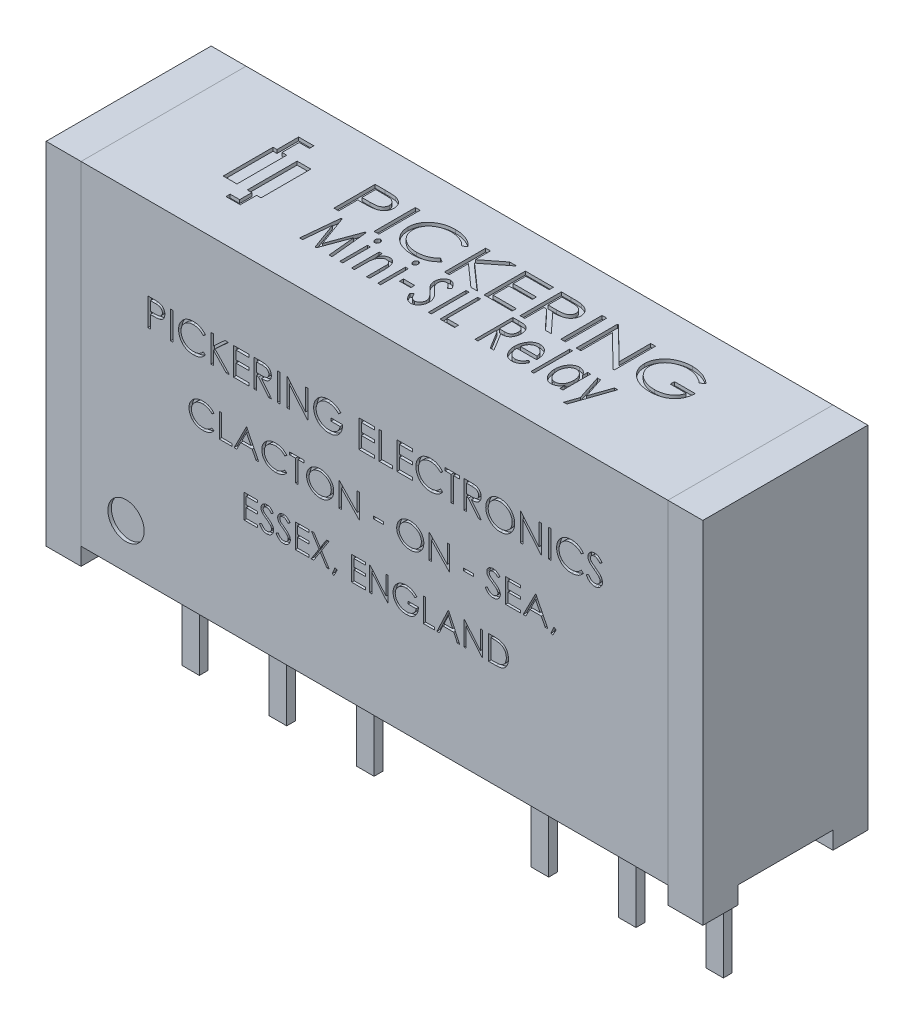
SolidWorks part; units mm, degrees
ref_plane "Front Plane" through (0, 0, 0) normal (0, 0, 1) x (1, 0, 0)
ref_plane "Top Plane" through (0, 0, 0) normal (0, 1, 0) x (1, 0, 0)
ref_plane "Right Plane" through (0, 0, 0) normal (1, 0, 0) x (0, 0, -1)
sketch "Sketch1" plane through (0, 0, 0) normal (0, 1, 0) x (1, 0, 0)
  line L1 (8.534, -2.4) -> (-8.534, -2.4)
  line L2 (8.534, -2.4) -> (8.534, 2.4)
  line L3 (8.534, 2.4) -> (-8.534, 2.4)
  line L4 (-8.534, -2.4) -> (-8.534, 2.4)
  line L5 (8.534, -2.4) -> (-8.534, 2.4) construction
  line L6 (8.534, 2.4) -> (-8.534, -2.4) construction
  point P0 (0, 0)
  dimension "D1" = 4.8
  dimension "D2" = 17.068
extrude "main box" add sketch "Sketch1" along normal blind 9.692
sketch "Sketch2" plane through (-8.534, 0, 0) normal (-1, 0, 0) x (0, 0, 1)
  line L0 (-2.4, 9.692) -> (2.4, 9.692)
  line L1 (2.4, 9.692) -> (2.4, -0.508)
  line L2 (2.4, -0.508) -> (-2.4, -0.508)
  line L3 (-2.4, -0.508) -> (-2.4, 9.692)
  dimension "D1" = 10.2
extrude "end section plus feet" add sketch "Sketch2" along normal blind 1.016 separate body
sketch "Sketch4" plane through (0, 0, 0) normal (0, -1, 0) x (1, 0, 0)
  line L1 (-7.874, -0.127) -> (-7.366, -0.127)
  line L2 (-7.874, -0.127) -> (-7.874, 0.127)
  line L3 (-7.874, 0.127) -> (-7.366, 0.127)
  line L4 (-7.366, -0.127) -> (-7.366, 0.127)
  line L5 (-7.874, -0.127) -> (-7.366, 0.127) construction
  line L6 (-7.874, 0.127) -> (-7.366, -0.127) construction
  line L7 (-5.334, -0.127) -> (-4.826, -0.127)
  line L8 (-5.334, -0.127) -> (-5.334, 0.127)
  line L9 (-5.334, 0.127) -> (-4.826, 0.127)
  line L10 (-4.826, -0.127) -> (-4.826, 0.127)
  line L11 (-5.334, -0.127) -> (-4.826, 0.127) construction
  line L12 (-5.334, 0.127) -> (-4.826, -0.127) construction
  line L13 (-2.286, -0.127) -> (-2.794, -0.127)
  line L14 (-2.286, -0.127) -> (-2.286, 0.127)
  line L15 (-2.286, 0.127) -> (-2.794, 0.127)
  line L16 (-2.794, -0.127) -> (-2.794, 0.127)
  line L17 (-2.286, -0.127) -> (-2.794, 0.127) construction
  line L18 (-2.286, 0.127) -> (-2.794, -0.127) construction
  line L19 (-9.55, 2.4) -> (-9.55, -2.4) construction
  line L20 (2.794, -0.127) -> (2.286, -0.127)
  line L21 (2.794, -0.127) -> (2.794, 0.127)
  line L22 (2.794, 0.127) -> (2.286, 0.127)
  line L23 (2.286, -0.127) -> (2.286, 0.127)
  line L24 (2.794, -0.127) -> (2.286, 0.127) construction
  line L25 (2.794, 0.127) -> (2.286, -0.127) construction
  line L26 (7.874, -0.127) -> (7.366, -0.127)
  line L27 (7.874, -0.127) -> (7.874, 0.127)
  line L28 (7.874, 0.127) -> (7.366, 0.127)
  line L29 (7.366, -0.127) -> (7.366, 0.127)
  line L30 (7.874, -0.127) -> (7.366, 0.127) construction
  line L31 (7.874, 0.127) -> (7.366, -0.127) construction
  line L32 (5.334, -0.127) -> (4.826, -0.127)
  line L33 (5.334, -0.127) -> (5.334, 0.127)
  line L34 (5.334, 0.127) -> (4.826, 0.127)
  line L35 (4.826, -0.127) -> (4.826, 0.127)
  line L36 (5.334, -0.127) -> (4.826, 0.127) construction
  line L37 (5.334, 0.127) -> (4.826, -0.127) construction
  point P0 (-7.62, 0)
  point P5 (-5.08, 0)
  point P11 (-2.54, 0)
  point P18 (2.54, 0)
  point P23 (7.62, 0)
  point P28 (5.08, 0)
  dimension "D1" = 0.254
  dimension "D2" = 0.508
  dimension "D3" = 5.08
  dimension "D4" = 0.508
  dimension "D5" = 0.254
  dimension "D6" = 0.508
  dimension "D7" = 1.93
  dimension "D8" = 0.254
  dimension "D9" = 2.54
  dimension "D10" = 5.08
  dimension "D11" = 0.254
  dimension "D12" = 0.508
  dimension "D13" = 0.254
  dimension "D14" = 0.508
  dimension "D15" = 5.08
  dimension "D16" = 0.508
  dimension "D17" = 0.254
  dimension "D18" = 2.54
extrude "Pins" add sketch "Sketch4" along normal blind 3.808
sketch "Sketch6"
  dimension "D1" = 10.15
  dimension "D2" = 9.25
  dimension "D3" = 5.7
  dimension "D4" = 6.05
  dimension "D5" = 2.3
  dimension "D6" = 1.25
extrude "Top writing" cut sketch "Sketch6" against normal blind 0.1
sketch "Sketch7"
  dimension "D1" = 14
  dimension "D2" = 2.55
extrude "Pickering electronics" cut sketch "Sketch7" against normal blind 0.1
sketch "Sketch8"
  dimension "D1" = 11
  dimension "D2" = 4
extrude "Address" cut sketch "Sketch8" against normal blind 0.1
sketch "Sketch9" plane through (0, 9.692, 0) normal (0, 1, 0) x (1, 0, 0)
  line L0 (8.534, 2.4) -> (-8.534, 2.4) construction
  line L1 (-5.4, 0.75) -> (-5, 0.75)
  line L2 (-5.4, 0.75) -> (-5.4, -0.7)
  line L3 (-5.4, -0.7) -> (-5.2668, -0.7)
  line L4 (-5, 0.75) -> (-5, -0.7)
  line L5 (-9.55, -2.4) -> (-9.55, 2.4) construction
  line L6 (-5.7, 0.75) -> (-5.8385, 0.75)
  line L7 (-5.7, 0.75) -> (-5.7, -0.7)
  line L8 (-5.7, -0.7) -> (-6.1, -0.7)
  line L9 (-6.1, 0.75) -> (-6.1, -0.7)
  line L10 (-5.9858, 0.75) -> (-6.1, 0.75)
  line L11 (-5.1282, -0.7) -> (-5, -0.7)
  line L12 (-5.9858, 0.75) -> (-5.9858, 1.3793)
  line L13 (-5.9858, 1.3793) -> (-5.8385, 1.3793)
  line L14 (-5.8385, 0.75) -> (-5.8385, 1.2494)
  line L15 (-5.8385, 1.3793) -> (-5.544, 1.3793)
  line L17 (-5.8385, 1.2494) -> (-5.544, 1.2494)
  line L18 (-5.544, 1.3793) -> (-5.544, 1.2494)
  line L20 (-5.1282, -0.7) -> (-5.1282, -1.176)
  line L21 (-5.1282, -1.176) -> (-5.2668, -1.176)
  line L22 (-5.2668, -0.7) -> (-5.2668, -1.0548)
  line L23 (-5.2668, -1.176) -> (-5.544, -1.176)
  line L25 (-5.2668, -1.0548) -> (-5.544, -1.0548)
  line L26 (-5.544, -1.176) -> (-5.544, -1.0548)
  dimension "D1" = 1.65
  dimension "D2" = 1.45
  dimension "D3" = 0.4
  dimension "D4" = 0.4
  dimension "D5" = 0.3
  dimension "D6" = 3.45
extrude "Pickering logo" cut sketch "Sketch9" against normal blind 0.1
sketch "Sketch10"
  dimension "D1" = 3.4
  dimension "D2" = 4
  dimension "D3" = 11.5
extrude "Relay type" add sketch "Sketch10" along normal blind 0.0001
sketch "Sketch11" plane through (8.534, 0, 0) normal (1, 0, 0) x (0, 0, -1)
  line L1 (-2.4, 9.692) -> (2.4, 9.692)
  line L2 (-2.4, 9.692) -> (-2.4, -0.508)
  line L3 (-2.4, -0.508) -> (2.4, -0.508)
  line L4 (2.4, 9.692) -> (2.4, -0.508)
extrude "Extrude8" add sketch "Sketch11" along normal blind 1.016 separate body
sketch "Sketch12" plane through (-9.55, 0, 0) normal (-1, 0, 0) x (0, 0, 1)
  line L0 (-2.4, -0.508) -> (2.4, -0.508) construction
  line L1 (-1.384, -0.508) -> (1.384, -0.508)
  line L2 (-1.384, -0.508) -> (-1.384, 0)
  line L3 (-1.384, 0) -> (1.384, 0)
  line L4 (1.384, -0.508) -> (1.384, 0)
  line L5 (2.4, -0.508) -> (2.4, 9.692) construction
  dimension "D1" = 0.508
  dimension "D2" = 2.768
  dimension "D3" = 1.016
extrude "Extrude9" cut sketch "Sketch12" against normal blind 1.016
sketch "Sketch13" plane through (9.55, 0, 0) normal (1, 0, 0) x (0, 0, -1)
  line L0 (-2.4, -0.508) -> (2.4, -0.508) construction
  line L1 (-1.384, -0.508) -> (1.384, -0.508)
  line L2 (-1.384, -0.508) -> (-1.384, 0)
  line L3 (-1.384, 0) -> (1.384, 0)
  line L4 (1.384, -0.508) -> (1.384, 0)
  line L6 (2.4, -0.508) -> (2.4, 9.692) construction
  dimension "D1" = 0.508
  dimension "D2" = 2.768
  dimension "D3" = 1.016
extrude "Extrude10" cut sketch "Sketch13" against normal blind 1.016
